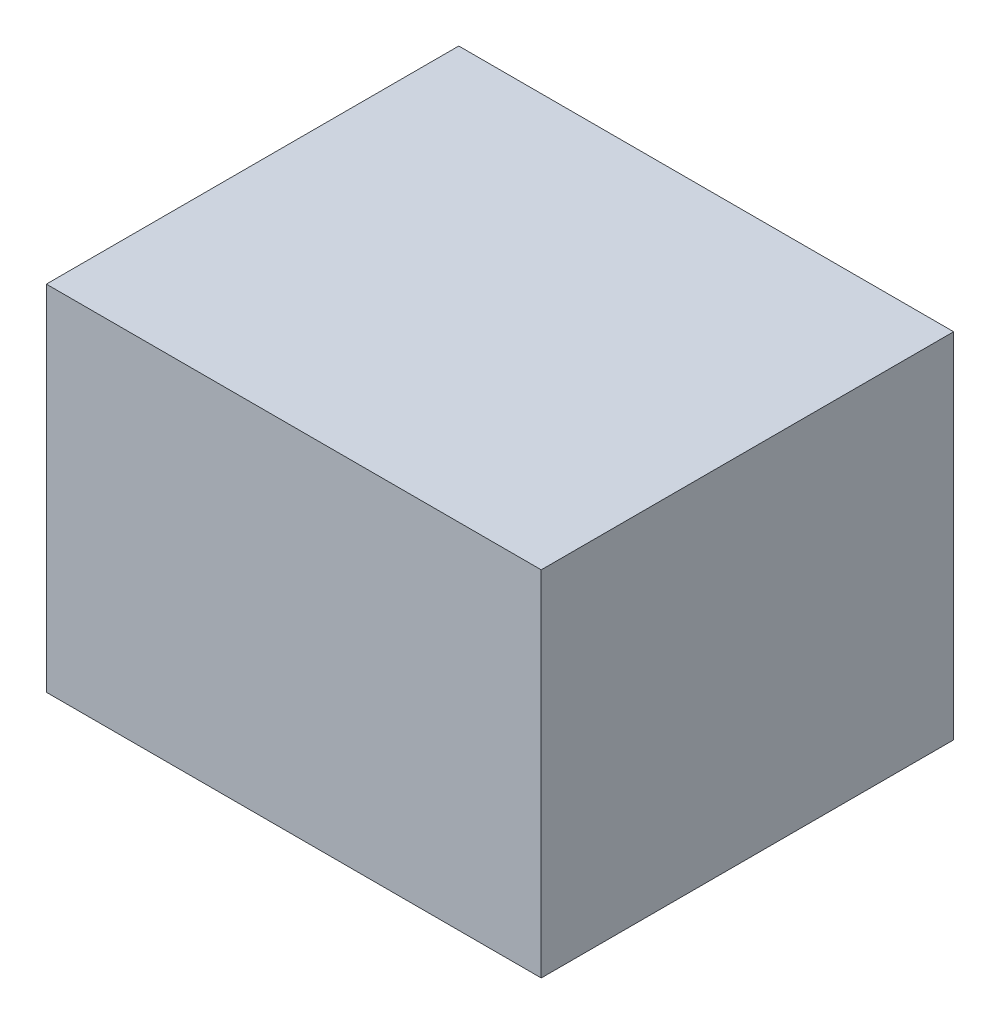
SolidWorks part; units mm, degrees
ref_plane "Alzado" through (0, 0, 0) normal (0, 0, 1) x (1, 0, 0)
ref_plane "Planta" through (0, 0, 0) normal (0, 1, 0) x (1, 0, 0)
ref_plane "Vista lateral" through (0, 0, 0) normal (1, 0, 0) x (0, 0, -1)
sketch "Croquis3" plane through (0, 0, 0) normal (0, 0, 1) x (1, 0, 0)
  line L1 (-210, -150) -> (210, -150)
  line L2 (-210, -150) -> (-210, 150)
  line L3 (-210, 150) -> (210, 150)
  line L4 (210, -150) -> (210, 150)
  line L5 (-210, -150) -> (210, 150) construction
  line L6 (-210, 150) -> (210, -150) construction
  point P0 (0, 0)
  dimension "D1" = 420
  dimension "D2" = 300
extrude "Saliente-Extruir1" add sketch "Croquis3" along normal blind 350
